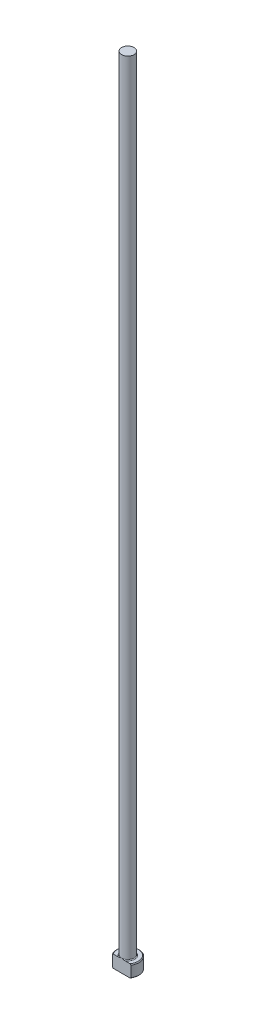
SolidWorks part; units mm, degrees
ref_plane "Front Plane" through (0, 0, 0) normal (0, 0, 1) x (1, 0, 0)
ref_plane "Top Plane" through (0, 0, 0) normal (0, 1, 0) x (1, 0, 0)
ref_plane "Right Plane" through (0, 0, 0) normal (1, 0, 0) x (0, 0, -1)
sketch "Sketch1" plane through (0, 0, 0) normal (0, 0, 1) x (1, 0, 0)
  line L0 (0, 259.9588) -> (0, -15.1925) construction
  line L1 (0, 0) -> (-3.5687, 0)
  line L2 (-3.5687, 0) -> (-3.5687, 3.9624)
  line L3 (-3.5687, 3.9624) -> (-1.9837, 3.9624)
  line L4 (-1.9837, 3.9624) -> (-1.9837, 254)
  line L5 (-1.9837, 254) -> (0, 254)
  line L6 (0, 254) -> (0, 0)
  dimension "L" = 254
  dimension "H" = 7.1374
  dimension "T" = 3.9624
  dimension "D" = 3.9675
revolve "Revolve1" add sketch "Sketch1" angle 360 about L0
chamfer "Chamfer1" distance 0.254 angle 45 2 edges at (0, 3.9624, 3.5687) (0, 0, 3.5687)
fillet "Fillet1" radius 0.254 1 edges at (0, 3.9624, 1.9837)
sketch "Sketch2" plane through (0, 0, 0) normal (0, -1, 0) x (1, 0, 0)
  line L0 (-2.9665, 1.9837) -> (2.9665, 1.9837)
  arc A0 (2.9665, 1.9837) -> (-2.9665, 1.9837) centre (0, 0) ccw
  circle A1 centre (0, 0) radius 3.5687 construction
  circle A3 centre (0, 0) radius 1.9837 construction
extrude "KEY" cut sketch "Sketch2" against normal through all
sketch "Pocket Sketch" plane through (0, 0, 0) normal (0, 0, 1) x (1, 0, 0)
  line L0 (-3.9656, 0) -> (-3.9656, 3.9878)
  line L1 (-3.9656, 3.9878) -> (-2.9442, 3.9878)
  line L2 (-2.1822, 4.7498) -> (-2.1822, 22.225)
  line L3 (-2.1822, 22.225) -> (0, 22.225)
  line L4 (0, 22.225) -> (0, 0)
  line L5 (0, 0) -> (-3.9656, 0)
  line L6 (0, 12.6104) -> (0, -2.4989) construction
  line L7 (-3.5687, 3.7084) -> (-3.5687, 0.254) construction
  line L8 (3.3147, 3.9624) -> (-3.3147, 3.9624) construction
  line L9 (-1.9837, 254) -> (-1.9837, 4.2164) construction
  line L10 (-2.9442, 3.9878) -> (-2.1822, 4.7498)
  point P3 (-2.1822, 3.9878)
  dimension "D1" = 7.9311
  dimension "D2" = 0.3969
  dimension "D3" = 0.0254
  dimension "D4" = 0.1984
  dimension "D5" = 4.3644
  dimension "D6" = 22.225
